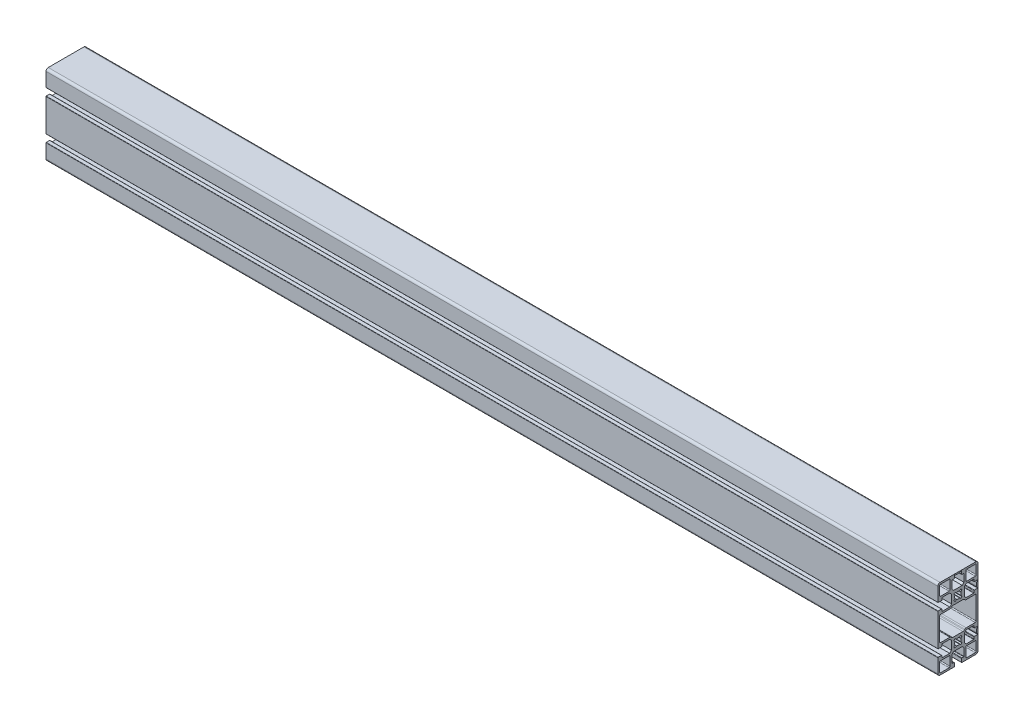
SolidWorks part; units mm, degrees
ref_plane "Front Plane" through (0, 0, 0) normal (0, 0, 1) x (1, 0, 0)
ref_plane "Top Plane" through (0, 0, 0) normal (0, 1, 0) x (1, 0, 0)
ref_plane "Right Plane" through (0, 0, 0) normal (1, 0, 0) x (0, 0, -1)
sketch3d "3DSketch1"
  line L0 (0, 0, 0) -> (1000, 0, 0)
  dimension "D1" = 1000
other "45-sarja 1.0110 45X90 VAHVA L 6M(1)"
ref_plane "Plane1" through (0, 0, 0) normal (1, 0, 0) x (0, 0, -1)
sketch "Sketch1" plane through (0, 0, 0) normal (1, 0, 0) x (0, 0, -1)
  line L0 (20.5, -42) -> (20.5, -32.3)
  line L1 (19.5, -31.3) -> (9.8, -31.3)
  line L2 (8.8, -32.3) -> (8.8, -42)
  line L3 (9.8, -43) -> (19.5, -43)
  line L4 (-8.8, -42) -> (-8.8, -32.3)
  line L5 (-19.5, -43) -> (-9.8, -43)
  line L6 (-20.5, -32.3) -> (-20.5, -42)
  line L7 (-9.8, -31.3) -> (-19.5, -31.3)
  line L8 (22.2, -18.7) -> (22.2, -18.4)
  line L9 (22.2, -18.4) -> (18.5, -18.4)
  line L10 (18, -17.9) -> (18, -16)
  line L11 (17.7, -15.7) -> (9.2, -15.7)
  line L12 (9.2, -15.7) -> (7.2, -17.7)
  line L13 (7.2, -17.7) -> (7.2, -27.3)
  line L14 (-6.8, -40.2) -> (-6.8, -31.7)
  line L15 (-6.8, -31.7) -> (-4.8, -29.7)
  line L16 (-4.8, -29.7) -> (4.8, -29.7)
  line L17 (4.8, -29.7) -> (6.8, -31.7)
  line L18 (6.8, -31.7) -> (6.8, -40.2)
  line L19 (6.5, -40.5) -> (4.6, -40.5)
  line L20 (4.1, -41) -> (4.1, -44.7)
  line L21 (4.4, -45) -> (20, -45)
  line L22 (22.5, -42.5) -> (22.5, 42.5)
  line L23 (20, 45) -> (-20, 45)
  line L24 (-22.5, 42.5) -> (-22.5, 26.9)
  line L25 (-22.2, 26.6) -> (-18.5, 26.6)
  line L26 (-18, 27.1) -> (-18, 29)
  line L27 (-17.7, 29.3) -> (-9.2, 29.3)
  line L28 (-9.2, 29.3) -> (-7.2, 27.3)
  line L29 (-7.2, 27.3) -> (-7.2, 17.7)
  line L30 (-7.2, 17.7) -> (-9.2, 15.7)
  line L31 (-9.2, 15.7) -> (-17.7, 15.7)
  line L32 (-18, 16) -> (-18, 17.9)
  line L33 (-18.5, 18.4) -> (-22.2, 18.4)
  line L34 (-22.5, 18.1) -> (-22.5, -18.1)
  line L35 (-22.2, -18.4) -> (-18.5, -18.4)
  line L36 (-18, -17.9) -> (-18, -16)
  line L37 (-17.7, -15.7) -> (-9.2, -15.7)
  line L38 (-9.2, -15.7) -> (-7.2, -17.7)
  line L39 (-7.2, -17.7) -> (-7.2, -27.3)
  line L40 (-7.2, -27.3) -> (-9.2, -29.3)
  line L41 (-9.2, -29.3) -> (-17.7, -29.3)
  line L42 (-18, -29) -> (-18, -27.1)
  line L43 (-18.5, -26.6) -> (-22.2, -26.6)
  line L44 (-22.5, -26.9) -> (-22.5, -42.5)
  line L45 (-20, -45) -> (-4.4, -45)
  line L46 (-4.1, -44.7) -> (-4.1, -41)
  line L47 (-4.6, -40.5) -> (-6.5, -40.5)
  line L48 (7.2, -27.3) -> (9.2, -29.3)
  line L49 (9.2, -29.3) -> (17.7, -29.3)
  line L50 (18, -29) -> (18, -27.1)
  line L51 (18.5, -26.6) -> (22.2, -26.6)
  line L52 (22.2, -26.6) -> (22.2, -26.3)
  line L53 (21, -24.25) -> (21, -20.75)
  line L54 (-4.3841, -19.5302) -> (-3.3633, -20.5509)
  line L55 (-3.3633, -24.4491) -> (-4.3841, -25.4698)
  line L56 (-4.3841, -25.8941) -> (-3.3941, -26.8841)
  line L57 (-2.9698, -26.8841) -> (-1.9491, -25.8633)
  line L58 (1.9491, -25.8633) -> (2.9698, -26.8841)
  line L59 (3.3941, -26.8841) -> (4.3841, -25.8941)
  line L60 (4.3841, -25.4698) -> (3.3633, -24.4491)
  line L61 (3.3633, -20.5509) -> (4.3841, -19.5302)
  line L62 (4.3841, -19.1059) -> (3.3941, -18.1159)
  line L63 (2.9698, -18.1159) -> (1.9491, -19.1367)
  line L64 (-1.9491, -19.1367) -> (-2.9698, -18.1159)
  line L65 (-3.3941, -18.1159) -> (-4.3841, -19.1059)
  line L66 (-20.5, 12.7) -> (-20.5, -12.7)
  line L67 (-19.5, -13.7) -> (-9.2, -13.7)
  line L68 (-7.7858, -14.2858) -> (-7.1574, -14.9142)
  line L69 (-5.7432, -15.5) -> (5.7432, -15.5)
  line L70 (7.1574, -14.9142) -> (7.7858, -14.2858)
  line L71 (9.2, -13.7) -> (19.5, -13.7)
  line L72 (20.5, -12.7) -> (20.5, 12.7)
  line L73 (19.5, 13.7) -> (9.2, 13.7)
  line L74 (7.7858, 14.2858) -> (7.1574, 14.9142)
  line L75 (5.7432, 15.5) -> (-5.7432, 15.5)
  line L76 (-7.1574, 14.9142) -> (-7.7858, 14.2858)
  line L77 (-9.2, 13.7) -> (-19.5, 13.7)
  line L78 (7.2, 27.3) -> (7.2, 17.7)
  line L79 (7.2, 17.7) -> (9.2, 15.7)
  line L80 (9.2, 15.7) -> (17.7, 15.7)
  line L81 (18, 16) -> (18, 17.9)
  line L82 (18.5, 18.4) -> (22.2, 18.4)
  line L83 (22.2, 18.4) -> (22.2, 18.7)
  line L84 (21, 20.75) -> (21, 24.25)
  line L85 (22.2, 26.3) -> (22.2, 26.6)
  line L86 (22.2, 26.6) -> (18.5, 26.6)
  line L87 (18, 27.1) -> (18, 29)
  line L88 (17.7, 29.3) -> (9.2, 29.3)
  line L89 (9.2, 29.3) -> (7.2, 27.3)
  line L90 (-4.3841, 25.4698) -> (-3.3633, 24.4491)
  line L91 (-3.3633, 20.5509) -> (-4.3841, 19.5302)
  line L92 (-4.3841, 19.1059) -> (-3.3941, 18.1159)
  line L93 (-2.9698, 18.1159) -> (-1.9491, 19.1367)
  line L94 (1.9491, 19.1367) -> (2.9698, 18.1159)
  line L95 (3.3941, 18.1159) -> (4.3841, 19.1059)
  line L96 (4.3841, 19.5302) -> (3.3633, 20.5509)
  line L97 (3.3633, 24.4491) -> (4.3841, 25.4698)
  line L98 (4.3841, 25.8941) -> (3.3941, 26.8841)
  line L99 (2.9698, 26.8841) -> (1.9491, 25.8633)
  line L100 (-1.9491, 25.8633) -> (-2.9698, 26.8841)
  line L101 (-3.3941, 26.8841) -> (-4.3841, 25.8941)
  line L102 (20.5, 32.3) -> (20.5, 42)
  line L103 (9.8, 31.3) -> (19.5, 31.3)
  line L104 (8.8, 42) -> (8.8, 32.3)
  line L105 (19.5, 43) -> (9.8, 43)
  line L106 (-3.8, 44.7) -> (-4.1, 44.7)
  line L107 (-4.1, 44.7) -> (-4.1, 41)
  line L108 (-4.6, 40.5) -> (-6.5, 40.5)
  line L109 (-6.8, 40.2) -> (-6.8, 31.7)
  line L110 (-6.8, 31.7) -> (-4.8, 29.7)
  line L111 (-4.8, 29.7) -> (4.8, 29.7)
  line L112 (4.8, 29.7) -> (6.8, 31.7)
  line L113 (6.8, 31.7) -> (6.8, 40.2)
  line L114 (6.5, 40.5) -> (4.6, 40.5)
  line L115 (4.1, 41) -> (4.1, 44.7)
  line L116 (4.1, 44.7) -> (3.7994, 44.7)
  line L117 (1.75, 43.5) -> (-1.75, 43.5)
  line L118 (-20.5, 42) -> (-20.5, 32.3)
  line L119 (-19.5, 31.3) -> (-9.8, 31.3)
  line L120 (-8.8, 32.3) -> (-8.8, 42)
  line L121 (-9.8, 43) -> (-19.5, 43)
  arc A0 (19.5, -43) -> (20.5, -42) centre (19.5, -42) ccw
  arc A1 (20.5, -32.3) -> (19.5, -31.3) centre (19.5, -32.3) ccw
  arc A2 (9.8, -31.3) -> (8.8, -32.3) centre (9.8, -32.3) ccw
  arc A3 (8.8, -42) -> (9.8, -43) centre (9.8, -42) ccw
  arc A4 (-8.8, -32.3) -> (-9.8, -31.3) centre (-9.8, -32.3) ccw
  arc A5 (-9.8, -43) -> (-8.8, -42) centre (-9.8, -42) ccw
  arc A6 (-20.5, -42) -> (-19.5, -43) centre (-19.5, -42) ccw
  arc A7 (-19.5, -31.3) -> (-20.5, -32.3) centre (-19.5, -32.3) ccw
  arc A8 (-6.8, -40.2) -> (-6.5, -40.5) centre (-6.5, -40.2) ccw
  arc A9 (6.5, -40.5) -> (6.8, -40.2) centre (6.5, -40.2) ccw
  arc A10 (4.6, -40.5) -> (4.1, -41) centre (4.6, -41) ccw
  arc A11 (4.1, -44.7) -> (4.4, -45) centre (4.4, -44.7) ccw
  arc A12 (20, -45) -> (22.5, -42.5) centre (20, -42.5) ccw
  arc A13 (22.5, 42.5) -> (20, 45) centre (20, 42.5) ccw
  arc A14 (-20, 45) -> (-22.5, 42.5) centre (-20, 42.5) ccw
  arc A15 (-22.5, 26.9) -> (-22.2, 26.6) centre (-22.2, 26.9) ccw
  arc A16 (-18.5, 26.6) -> (-18, 27.1) centre (-18.5, 27.1) ccw
  arc A17 (-17.7, 29.3) -> (-18, 29) centre (-17.7, 29) ccw
  arc A18 (-18, 16) -> (-17.7, 15.7) centre (-17.7, 16) ccw
  arc A19 (-18, 17.9) -> (-18.5, 18.4) centre (-18.5, 17.9) ccw
  arc A20 (-22.2, 18.4) -> (-22.5, 18.1) centre (-22.2, 18.1) ccw
  arc A21 (-22.5, -18.1) -> (-22.2, -18.4) centre (-22.2, -18.1) ccw
  arc A22 (-18.5, -18.4) -> (-18, -17.9) centre (-18.5, -17.9) ccw
  arc A23 (-17.7, -15.7) -> (-18, -16) centre (-17.7, -16) ccw
  arc A24 (-18, -29) -> (-17.7, -29.3) centre (-17.7, -29) ccw
  arc A25 (-18, -27.1) -> (-18.5, -26.6) centre (-18.5, -27.1) ccw
  arc A26 (-22.2, -26.6) -> (-22.5, -26.9) centre (-22.2, -26.9) ccw
  arc A27 (-22.5, -42.5) -> (-20, -45) centre (-20, -42.5) ccw
  arc A28 (-4.4, -45) -> (-4.1, -44.7) centre (-4.4, -44.7) ccw
  arc A29 (-4.1, -41) -> (-4.6, -40.5) centre (-4.6, -41) ccw
  arc A30 (18, -17.9) -> (18.5, -18.4) centre (18.5, -17.9) ccw
  arc A31 (18, -16) -> (17.7, -15.7) centre (17.7, -16) ccw
  arc A32 (17.7, -29.3) -> (18, -29) centre (17.7, -29) ccw
  arc A33 (18.5, -26.6) -> (18, -27.1) centre (18.5, -27.1) ccw
  arc A34 (21, -24.25) -> (22.2, -26.3) centre (23.351, -24.25) ccw
  arc A35 (22.2, -18.7) -> (21, -20.75) centre (23.351, -20.75) ccw
  arc A36 (-4.3841, -19.1059) -> (-4.3841, -19.5302) centre (-4.1719, -19.318) ccw
  arc A37 (-3.3056, -20.8941) -> (-3.3633, -20.5509) centre (-3.5754, -20.7631) ccw
  arc A38 (-3.3056, -20.8941) -> (-3.3056, -24.1059) centre (0, -22.5) ccw
  arc A39 (-3.3633, -24.4491) -> (-3.3056, -24.1059) centre (-3.5754, -24.2369) ccw
  arc A40 (-4.3841, -25.4698) -> (-4.3841, -25.8941) centre (-4.1719, -25.682) ccw
  arc A41 (-3.3941, -26.8841) -> (-2.9698, -26.8841) centre (-3.182, -26.6719) ccw
  arc A42 (-1.6059, -25.8056) -> (-1.9491, -25.8633) centre (-1.7369, -26.0754) ccw
  arc A43 (-1.6059, -25.8056) -> (1.6059, -25.8056) centre (0, -22.5) ccw
  arc A44 (1.9491, -25.8633) -> (1.6059, -25.8056) centre (1.7369, -26.0754) ccw
  arc A45 (2.9698, -26.8841) -> (3.3941, -26.8841) centre (3.182, -26.6719) ccw
  arc A46 (4.3841, -25.8941) -> (4.3841, -25.4698) centre (4.1719, -25.682) ccw
  arc A47 (3.3056, -24.1059) -> (3.3633, -24.4491) centre (3.5754, -24.2369) ccw
  arc A48 (3.3056, -24.1059) -> (3.3056, -20.8941) centre (0, -22.5) ccw
  arc A49 (3.3633, -20.5509) -> (3.3056, -20.8941) centre (3.5754, -20.7631) ccw
  arc A50 (4.3841, -19.5302) -> (4.3841, -19.1059) centre (4.1719, -19.318) ccw
  arc A51 (3.3941, -18.1159) -> (2.9698, -18.1159) centre (3.182, -18.3281) ccw
  arc A52 (1.6059, -19.1944) -> (1.9491, -19.1367) centre (1.7369, -18.9246) ccw
  arc A53 (1.6059, -19.1944) -> (-1.6059, -19.1944) centre (0, -22.5) ccw
  arc A54 (-1.9491, -19.1367) -> (-1.6059, -19.1944) centre (-1.7369, -18.9246) ccw
  arc A55 (-2.9698, -18.1159) -> (-3.3941, -18.1159) centre (-3.182, -18.3281) ccw
  arc A56 (-20.5, -12.7) -> (-19.5, -13.7) centre (-19.5, -12.7) ccw
  arc A57 (-7.7858, -14.2858) -> (-9.2, -13.7) centre (-9.2, -15.7) ccw
  arc A58 (-7.1574, -14.9142) -> (-5.7432, -15.5) centre (-5.7432, -13.5) ccw
  arc A59 (5.7432, -15.5) -> (7.1574, -14.9142) centre (5.7432, -13.5) ccw
  arc A60 (9.2, -13.7) -> (7.7858, -14.2858) centre (9.2, -15.7) ccw
  arc A61 (19.5, -13.7) -> (20.5, -12.7) centre (19.5, -12.7) ccw
  arc A62 (20.5, 12.7) -> (19.5, 13.7) centre (19.5, 12.7) ccw
  arc A63 (7.7858, 14.2858) -> (9.2, 13.7) centre (9.2, 15.7) ccw
  arc A64 (7.1574, 14.9142) -> (5.7432, 15.5) centre (5.7432, 13.5) ccw
  arc A65 (-5.7432, 15.5) -> (-7.1574, 14.9142) centre (-5.7432, 13.5) ccw
  arc A66 (-9.2, 13.7) -> (-7.7858, 14.2858) centre (-9.2, 15.7) ccw
  arc A67 (-19.5, 13.7) -> (-20.5, 12.7) centre (-19.5, 12.7) ccw
  arc A68 (17.7, 15.7) -> (18, 16) centre (17.7, 16) ccw
  arc A69 (18.5, 18.4) -> (18, 17.9) centre (18.5, 17.9) ccw
  arc A70 (21, 20.75) -> (22.2, 18.7) centre (23.351, 20.75) ccw
  arc A71 (22.2, 26.3) -> (21, 24.25) centre (23.351, 24.25) ccw
  arc A72 (18, 27.1) -> (18.5, 26.6) centre (18.5, 27.1) ccw
  arc A73 (18, 29) -> (17.7, 29.3) centre (17.7, 29) ccw
  arc A74 (-4.3841, 25.8941) -> (-4.3841, 25.4698) centre (-4.1719, 25.682) ccw
  arc A75 (-3.3056, 24.1059) -> (-3.3633, 24.4491) centre (-3.5754, 24.2369) ccw
  arc A76 (-3.3056, 24.1059) -> (-3.3056, 20.8941) centre (0, 22.5) ccw
  arc A77 (-3.3633, 20.5509) -> (-3.3056, 20.8941) centre (-3.5754, 20.7631) ccw
  arc A78 (-4.3841, 19.5302) -> (-4.3841, 19.1059) centre (-4.1719, 19.318) ccw
  arc A79 (-3.3941, 18.1159) -> (-2.9698, 18.1159) centre (-3.182, 18.3281) ccw
  arc A80 (-1.6059, 19.1944) -> (-1.9491, 19.1367) centre (-1.7369, 18.9246) ccw
  arc A81 (-1.6059, 19.1944) -> (1.6059, 19.1944) centre (0, 22.5) ccw
  arc A82 (1.9491, 19.1367) -> (1.6059, 19.1944) centre (1.7369, 18.9246) ccw
  arc A83 (2.9698, 18.1159) -> (3.3941, 18.1159) centre (3.182, 18.3281) ccw
  arc A84 (4.3841, 19.1059) -> (4.3841, 19.5302) centre (4.1719, 19.318) ccw
  arc A85 (3.3056, 20.8941) -> (3.3633, 20.5509) centre (3.5754, 20.7631) ccw
  arc A86 (3.3056, 20.8941) -> (3.3056, 24.1059) centre (0, 22.5) ccw
  arc A87 (3.3633, 24.4491) -> (3.3056, 24.1059) centre (3.5754, 24.2369) ccw
  arc A88 (4.3841, 25.4698) -> (4.3841, 25.8941) centre (4.1719, 25.682) ccw
  arc A89 (3.3941, 26.8841) -> (2.9698, 26.8841) centre (3.182, 26.6719) ccw
  arc A90 (1.6059, 25.8056) -> (1.9491, 25.8633) centre (1.7369, 26.0754) ccw
  arc A91 (1.6059, 25.8056) -> (-1.6059, 25.8056) centre (0, 22.5) ccw
  arc A92 (-1.9491, 25.8633) -> (-1.6059, 25.8056) centre (-1.7369, 26.0754) ccw
  arc A93 (-2.9698, 26.8841) -> (-3.3941, 26.8841) centre (-3.182, 26.6719) ccw
  arc A94 (20.5, 42) -> (19.5, 43) centre (19.5, 42) ccw
  arc A95 (19.5, 31.3) -> (20.5, 32.3) centre (19.5, 32.3) ccw
  arc A96 (8.8, 32.3) -> (9.8, 31.3) centre (9.8, 32.3) ccw
  arc A97 (9.8, 43) -> (8.8, 42) centre (9.8, 42) ccw
  arc A98 (-4.6, 40.5) -> (-4.1, 41) centre (-4.6, 41) ccw
  arc A99 (-6.5, 40.5) -> (-6.8, 40.2) centre (-6.5, 40.2) ccw
  arc A100 (6.8, 40.2) -> (6.5, 40.5) centre (6.5, 40.2) ccw
  arc A101 (4.1, 41) -> (4.6, 40.5) centre (4.6, 41) ccw
  arc A102 (1.75, 43.5) -> (3.7994, 44.7) centre (1.75, 45.85) ccw
  arc A103 (-3.8, 44.7) -> (-1.75, 43.5) centre (-1.75, 45.851) ccw
  arc A104 (-20.5, 32.3) -> (-19.5, 31.3) centre (-19.5, 32.3) ccw
  arc A105 (-9.8, 31.3) -> (-8.8, 32.3) centre (-9.8, 32.3) ccw
  arc A106 (-8.8, 42) -> (-9.8, 43) centre (-9.8, 42) ccw
  arc A107 (-19.5, 43) -> (-20.5, 42) centre (-19.5, 42) ccw
  point P332 (0, 0)
